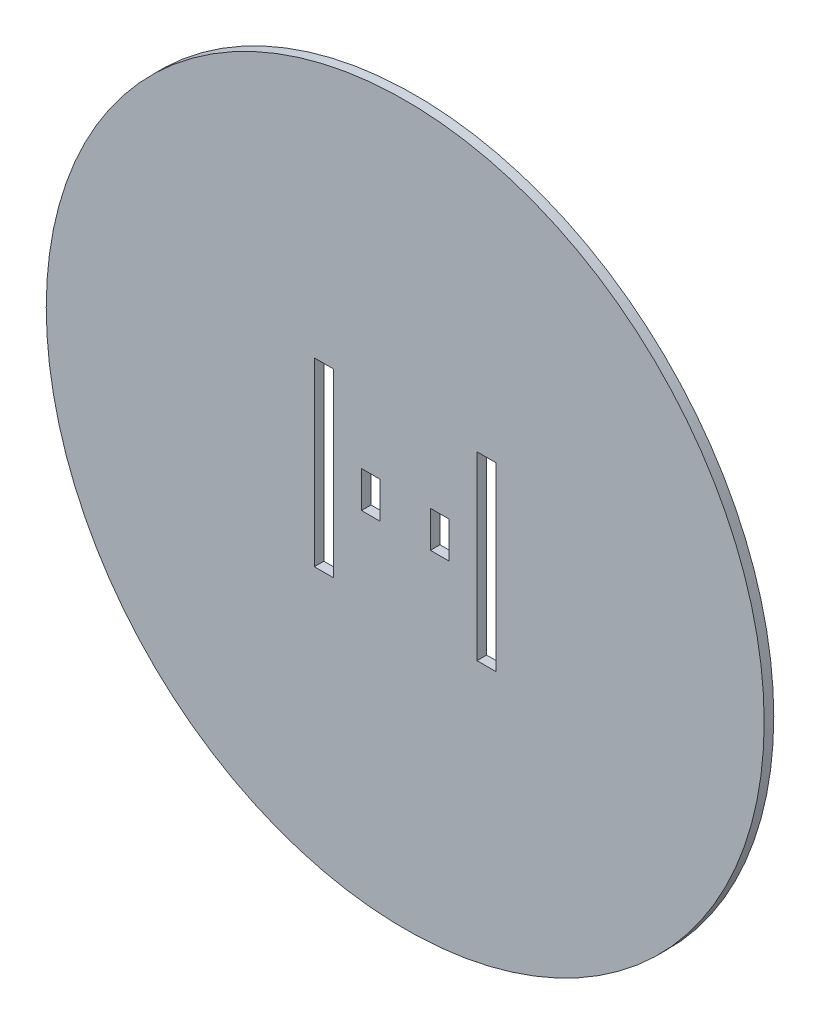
SolidWorks part; units mm, degrees
ref_plane "Front Plane" through (0, 0, 0) normal (0, 0, 1) x (1, 0, 0)
ref_plane "Top Plane" through (0, 0, 0) normal (0, 1, 0) x (1, 0, 0)
ref_plane "Right Plane" through (0, 0, 0) normal (1, 0, 0) x (0, 0, -1)
sketch "Sketch1" plane through (0, 0, 0) normal (0, 0, 1) x (1, 0, 0)
  line L0 (0, -1000) -> (0, 49000) construction
  line L1 (-1000, 0) -> (49000, 0) construction
  line L2 (13.7, -5.7) -> (7.9, -5.7)
  line L3 (-13.7, -5.7) -> (-7.9, -5.7)
  line L4 (-13.7, -5.7) -> (-13.7, 5.7)
  line L5 (-13.7, 5.7) -> (-7.9, 5.7)
  line L6 (-7.9, -5.7) -> (-7.9, 5.7)
  line L7 (13.7, -5.7) -> (13.7, 5.7)
  line L8 (7.9, -5.7) -> (7.9, 5.7)
  line L9 (13.7, 5.7) -> (7.9, 5.7)
  line L10 (28.48, -28.34) -> (22.5, -28.34)
  line L11 (-102.5, 41.7588) -> (102.5, 41.7588) construction
  line L12 (-102.5, 41.7588) -> (-102.5, -41.7588) construction
  line L13 (-102.5, -41.7588) -> (102.5, -41.7588) construction
  line L14 (102.5, 41.7588) -> (102.5, -41.7588) construction
  line L15 (-102.5, 41.7588) -> (102.5, -41.7588) construction
  line L16 (-102.5, -41.7588) -> (102.5, 41.7588) construction
  line L17 (-28.48, 28.34) -> (-22.5, 28.34)
  line L18 (-28.48, 28.34) -> (-28.48, -28.34)
  line L19 (-28.48, -28.34) -> (-22.5, -28.34)
  line L20 (-22.5, 28.34) -> (-22.5, -28.34)
  line L21 (-28.48, 28.34) -> (-22.5, -28.34) construction
  line L22 (-28.48, -28.34) -> (-22.5, 28.34) construction
  line L23 (28.48, 28.34) -> (28.48, -28.34)
  line L24 (22.5, 28.34) -> (22.5, -28.34)
  line L25 (28.48, 28.34) -> (22.5, 28.34)
  circle A0 centre (0, 0) radius 112.5
  point P19 (-25.49, 0)
  dimension "D1" = 225
  dimension "D2" = 5.8
  dimension "D3" = 11.4
  dimension "D4" = 15.8
  dimension "D5" = 205
  dimension "D6" = 56.68
  dimension "D7" = 5.98
  dimension "D8" = 45
extrude "Boss-Extrude1" add sketch "Sketch1" along normal blind 3
